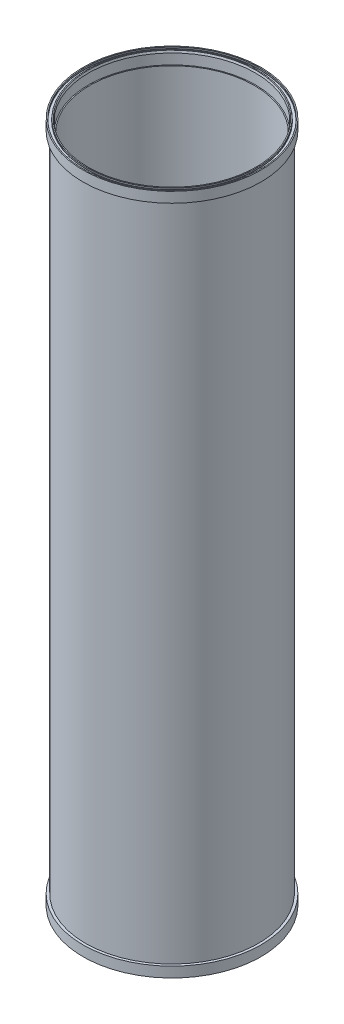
SolidWorks part; units mm, degrees
other "Static 2D"
ref_plane "Front Plane" through (0, 0, 0) normal (0, 0, 1) x (1, 0, 0)
ref_plane "Top Plane" through (0, 0, 0) normal (0, 1, 0) x (1, 0, 0)
ref_plane "Right Plane" through (0, 0, 0) normal (1, 0, 0) x (0, 0, -1)
ref_axis "Axis1" through (0, 880.11, 0) along (0, -1, 0)
sketch "Sketch1" plane through (0, 0, 0) normal (0, 0, 1) x (1, 0, 0)
  line L0 (0, 0) -> (0, 324.6281) construction
  line L1 (-109.5375, 838.2) -> (-103.3093, 838.2)
  line L2 (-102.6287, 835.66) -> (-102.6287, 822.96)
  line L3 (-109.5375, 0) -> (-103.3093, 0)
  line L4 (-101.3587, 822.96) -> (-101.3587, 15.24)
  line L5 (-109.5375, 838.2) -> (-109.5375, 0)
  line L6 (-102.6287, 822.96) -> (-101.3587, 822.96)
  line L7 (-102.6287, 2.54) -> (-102.6287, 15.24)
  line L8 (-102.6287, 15.24) -> (-101.3587, 15.24)
  line L9 (-103.3093, 838.2) -> (-102.6287, 835.66)
  line L10 (-109.5375, 0) -> (-119.5862, 0) construction
  line L11 (-103.3093, 0) -> (-102.6287, 2.54)
  dimension "D1" = 202.7174
  dimension "D2" = 219.075
  dimension "D3" = 15.24
  dimension "D4" = 15.24
  dimension "D5" = 15
  dimension "D6" = 838.2
  dimension "D7" = 15
  dimension "D8" = 2.54
  dimension "D9" = 2.54
  dimension "D10" = 205.2574
revolve "Revolve1" add sketch "Sketch1" angle 360 about L0
sketch "Sketch4" plane through (0, 0, 0) normal (0, 0, 1) x (1, 0, 0)
  line L0 (-101.3587, 822.96) -> (-101.3587, 15.24) construction
  line L1 (-109.5375, 825.5) -> (-106.4387, 825.5)
  line L2 (-109.5375, 825.5) -> (-109.5375, 12.7)
  line L3 (-109.5375, 12.7) -> (-106.4387, 12.7)
  line L4 (-106.4387, 825.5) -> (-106.4387, 12.7)
  line L5 (-109.5375, 838.2) -> (-103.3093, 838.2) construction
  line L6 (-109.5375, 838.2) -> (-109.5375, 0) construction
  line L7 (-109.5375, 0) -> (-103.3093, 0) construction
  dimension "D1" = 5.08
  dimension "D2" = 12.7
  dimension "D3" = 12.7
revolve "Cut-Revolve2" cut sketch "Sketch4" angle 360 about axis through (0, 880.11, 0) along (0, -1, 0)
sketch "Sketch5" plane through (0, 0, 0) normal (0, 0, 1) x (1, 0, 0)
  line L0 (-108.2675, 838.2) -> (-104.4829, 838.2)
  line L1 (-104.6099, 838.073) -> (-104.6099, 836.4982)
  line L2 (-104.8639, 836.2442) -> (-107.8865, 836.2442)
  line L3 (-106.3752, 836.2442) -> (-106.3752, 838.2) construction
  line L4 (-108.1405, 838.073) -> (-108.1405, 836.4982)
  line L5 (-109.5375, 838.2) -> (-103.3093, 838.2) construction
  line L6 (0, 880.11) -> (0, -41.91) construction
  line L7 (0, 0) -> (0, 912.2666) construction
  line L8 (-109.5375, 838.2) -> (-109.5375, 0) construction
  arc A0 (-104.4829, 838.2) -> (-104.6099, 838.073) centre (-104.4829, 838.073) ccw
  arc A1 (-108.2675, 838.2) -> (-108.1405, 838.073) centre (-108.2675, 838.073) cw
  arc A2 (-108.1405, 836.4982) -> (-107.8865, 836.2442) centre (-107.8865, 836.4982) ccw
  arc A3 (-104.6099, 836.4982) -> (-104.8639, 836.2442) centre (-104.8639, 836.4982) cw
  point P21 (-108.1405, 836.2442)
  point P24 (-104.6099, 836.2442)
  dimension "D1" = 0.127
  dimension "D6" = 0.254
  dimension "D2" = 3.5306
  dimension "D3" = 1.9558
  dimension "D4" = 209.2198
  dimension "D5" = 1.397
revolve "2-172 O-Ring" cut sketch "Sketch5" angle 360 about L7
ref_plane "Plane1" through (0, 419.1, 0) normal (0, 1, 0) x (1, 0, 0)
mirror "Mirror1" about plane through (0, 419.1, 0) normal (0, 1, 0) of "2-172 O-Ring"
